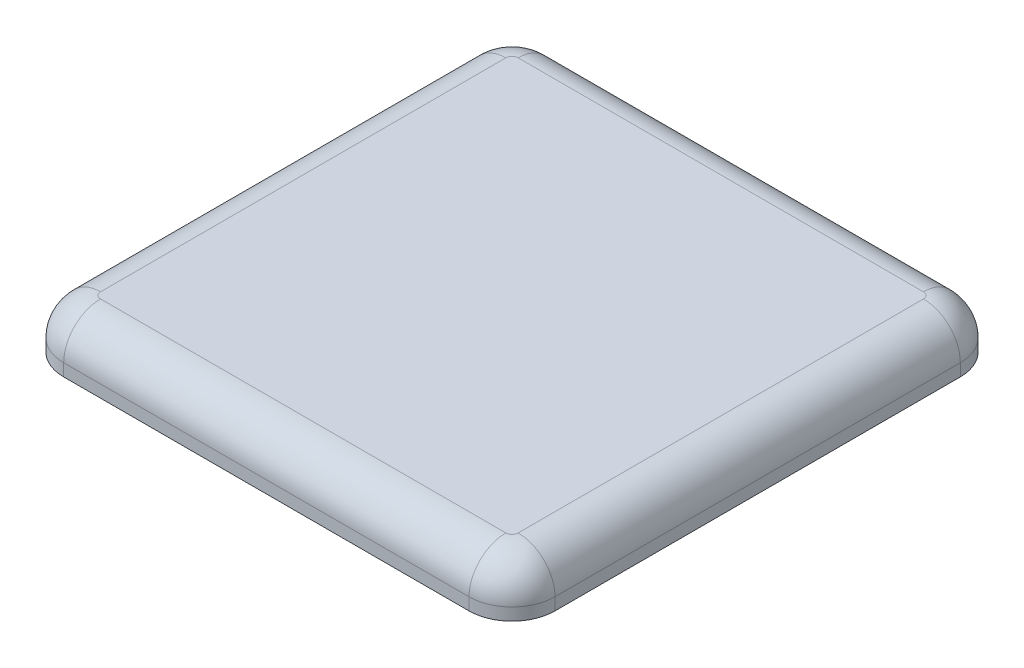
SolidWorks part; units mm, degrees
other "<10009-01-0000-00_abdeckkappe_4040>-<Arrow>"
ref_plane "Ebene vorne" through (0, 0, 0) normal (0, 0, 1) x (1, 0, 0)
ref_plane "Ebene oben" through (0, 0, 0) normal (0, 1, 0) x (1, 0, 0)
ref_plane "Ebene rechts" through (0, 0, 0) normal (1, 0, 0) x (0, 0, -1)
inserted part "10009-01-0000-00_abdeckkappe_4040"
other "Fläche verschieben1" parameters "D1"=90
